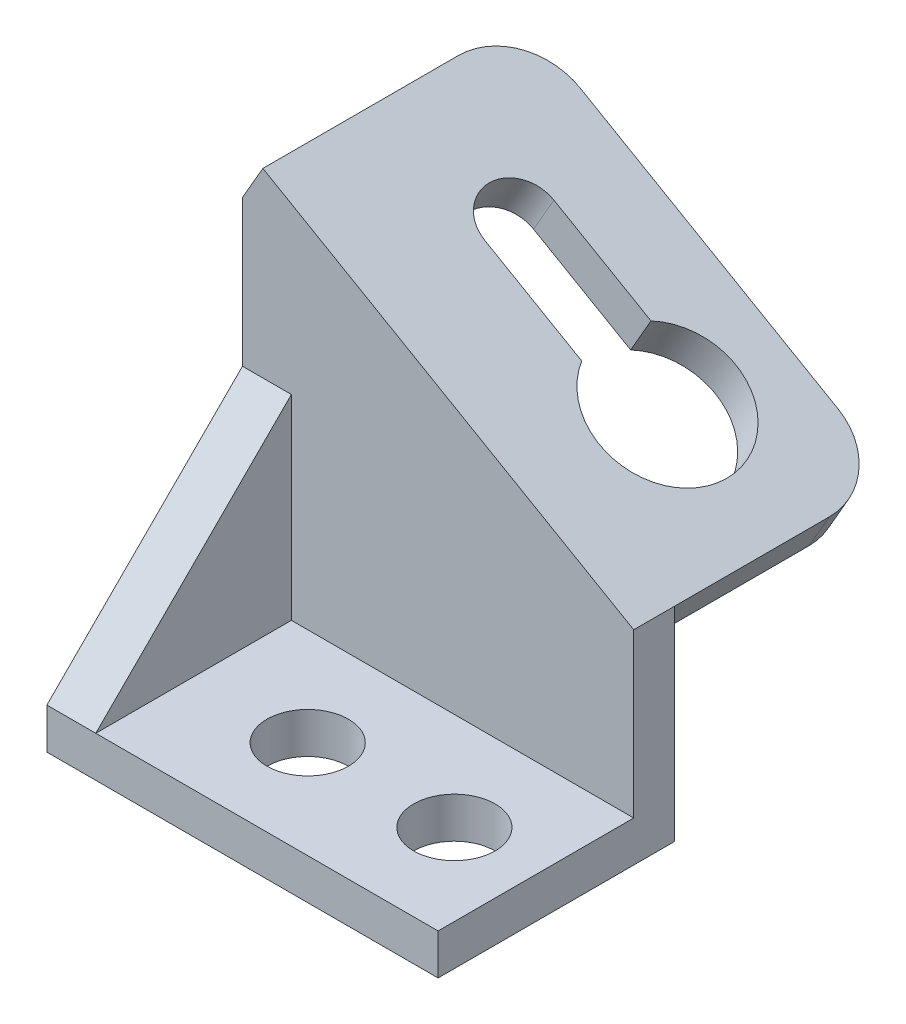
SolidWorks part; units mm, degrees
ref_plane "Front" through (0, 0, 0) normal (0, 0, 1) x (1, 0, 0)
ref_plane "Top" through (0, 0, 0) normal (0, 1, 0) x (1, 0, 0)
ref_plane "Right" through (0, 0, 0) normal (1, 0, 0) x (0, 0, -1)
sketch "Sketch1" plane through (0, 0, 0) normal (1, 0, 0) x (0, 0, -1)
  line L0 (0, 0) -> (0, 31.75)
  line L1 (0, 0) -> (-38.1, 0)
  dimension "D1" = 38.1
  dimension "D2" = 31.75
extrude "Base-Extrude-Thin" add sketch "Sketch1" along normal blind 76.2 thin
ref_plane "Plane5" through (32.7982, 56.8081, 0) normal (0.5, 0.866, 0) x (-0.866, 0.5, 0)
sketch "Sketch2" plane through (0, 31.75, 0) normal (0, 1, 0) x (-1, 0, 0)
  line L4 (0, 0) -> (-76.2, 0)
  line L5 (-76.2, 0) -> (-76.2, -7.9375)
  line L6 (-76.2, -7.9375) -> (0, -7.9375)
  line L7 (0, -7.9375) -> (0, 0)
  line L8 (0, 0) -> (-76.2, 0)
  line L9 (-76.2, 0) -> (-76.2, -7.9375)
  line L10 (-76.2, -7.9375) -> (0, -7.9375)
  line L11 (0, -7.9375) -> (0, 0)
  dimension "D1" = 0
extrude "Boss-Extrude1" add sketch "Sketch2" along normal up to surface
sketch "Sketch3" plane through (32.7982, 56.8081, 0) normal (0.5, 0.866, 0) x (-0.866, 0.5, 0)
  line L0 (37.872, -7.9375) -> (37.872, 0) construction
  line L1 (37.872, 0) -> (-50.1161, 0) construction
  line L2 (-50.1161, 0) -> (-50.1161, -7.9375) construction
  line L3 (37.872, -50.8) -> (37.872, 0)
  line L4 (37.872, 0) -> (-50.1161, 0)
  line L5 (-50.1161, 0) -> (-50.1161, -50.8)
  line L6 (37.872, -50.8) -> (-50.1161, -50.8)
  dimension "D1" = 50.8
extrude "Boss-Extrude2" add sketch "Sketch3" against normal blind 7.9375
sketch "Sketch4" plane through (0, 0, 0) normal (0, 0, 1) x (1, 0, 0)
  line L1 (0, 66.5787) -> (3.9687, 73.4527)
  line L3 (0, 75.7441) -> (76.2, 31.75) construction
extrude "Cut-Extrude1" cut sketch "Sketch4" against normal through all
fillet "Fillet1" radius 12.7 2 edges at (74.2156, 28.313, -50.8) (1.9844, 70.0157, -50.8)
sketch "Sketch5" plane through (0, 0, 0) normal (-1, 0, 0) x (0, 0, 1)
  line L0 (0, 66.5787) -> (0, 0) construction
  line L1 (0, 0) -> (38.1, 0) construction
  line L2 (0, 38.1) -> (0, 0)
  line L3 (0, 0) -> (38.1, 0)
  line L4 (38.1, 0) -> (0, 38.1)
  dimension "D1" = 38.1
extrude "Boss-Extrude3" add sketch "Sketch5" against normal blind 9.525
sketch "Sketch6" plane through (24.6549, 61.5096, -0.6135) normal (0.5, 0.866, 0) x (-0.866, 0.5, 0)
  line L0 (33.2893, -27.9615) -> (-34.1191, -27.9615) construction
  line L1 (-59.5191, -7.324) -> (-59.5191, -37.4865) construction
  line L2 (-0.7816, -34.7084) -> (-22.6169, -34.7084)
  line L3 (-0.7816, -21.2146) -> (-22.6169, -21.2146)
  line L4 (23.8863, 0.6135) -> (-59.5191, 0.6135) construction
  arc A0 (-0.7816, -21.2146) -> (-0.7816, -34.7084) centre (-0.7816, -27.9615) cw
  arc A1 (-22.6169, -34.7084) -> (-22.6169, -21.2146) centre (-34.1191, -27.9615) cw
  dimension "D2" = 33.3375
  dimension "D3" = 26.67
  dimension "D1" = 25.4
  dimension "D4" = 13.4937
  dimension "D5" = 28.575
extrude "Cut-Extrude2" cut sketch "Sketch6" against normal through all
sketch "Sketch9" plane through (0, 0, 0) normal (0, 1, 0) x (-1, 0, 0)
  line L0 (-76.2, 0) -> (-9.525, 0) construction
  line L1 (-76.2, 0) -> (-76.2, 38.1) construction
  circle A0 centre (-60.325, 19.05) radius 7.9375
  dimension "D1" = 15.875
  dimension "D2" = 19.05
  dimension "D3" = 15.875
extrude "Cut-Extrude3" cut sketch "Sketch9" against normal through all
pattern_linear "LPattern2" count 2 spacing 28.575 along (-1, 0, 0) of "Cut-Extrude3"
